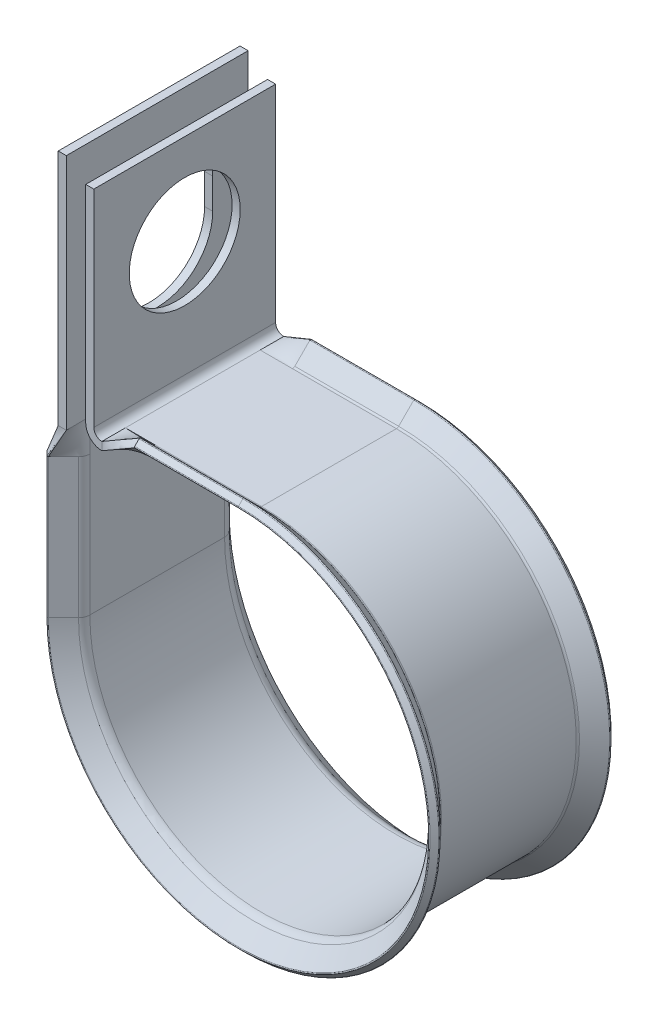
SolidWorks part; units mm, degrees
ref_plane "Front Plane" through (0, 0, 0) normal (0, 0, 1) x (1, 0, 0)
ref_plane "Top Plane" through (0, 0, 0) normal (0, 1, 0) x (1, 0, 0)
ref_plane "Right Plane" through (0, 0, 0) normal (1, 0, 0) x (0, 0, -1)
sketch "Sketch1" plane through (0, 0, 0) normal (0, 0, 1) x (1, 0, 0)
  line L0 (0, -23.8252) -> (0, 8.3312)
  line L1 (13.4874, -10.3378) -> (2.794, -10.3378)
  line L2 (1.524, -9.0678) -> (1.524, 7.1374)
  arc A0 (0, -23.8252) -> (13.4874, -10.3378) centre (13.4874, -23.8252) ccw
  arc A1 (2.794, -10.3378) -> (1.524, -9.0678) centre (2.794, -9.0678) cw
  dimension "D3" = 1.27
  dimension "D Clamp Diameter" = 26.9748
  dimension "L Center to Center" = 23.8252
  dimension "F Slot Center to End" = 8.3312
  dimension "E Hole Center to End" = 7.1374
  dimension "D6" = 1.524
extrude "Extrude-Thin1" add sketch "Sketch1" along normal mid plane 14.2748 thin
sketch "Sketch2" plane through (2.159, 0, 0) normal (1, 0, 0) x (0, 0, -1)
  circle A0 centre (0, 0) radius 4.3561
  dimension "H Hole Diameter" = 8.7122
extrude "Cut-Extrude1" cut sketch "Sketch2" against normal up to next
sketch "Sketch3" plane through (-0.635, 0, 0) normal (-1, 0, 0) x (0, 0, 1)
  line L0 (0, -1.1938) -> (0, 1.1938) construction
  line L1 (-4.3561, -1.1938) -> (-4.3561, 1.1938)
  line L2 (4.3561, -1.1938) -> (4.3561, 1.1938)
  arc A0 (-4.3561, -1.1938) -> (4.3561, -1.1938) centre (0, -1.1938) ccw
  arc A1 (4.3561, 1.1938) -> (-4.3561, 1.1938) centre (0, 1.1938) ccw
  point P2 (0, 0)
  dimension "H Slot Width" = 8.7122
  dimension "S Slot Length" = 11.0998
extrude "Cut-Extrude2" cut sketch "Sketch3" against normal up to next
sketch "Sketch4" plane through (0, 0, 0) normal (0, 0, 1) x (1, 0, 0)
  line L0 (2.794, -10.3378) -> (13.4874, -10.3378)
  line L1 (0, -23.8252) -> (0, -10.3378)
  line L2 (0, 8.3312) -> (0, -23.8252) construction
  arc A0 (13.4874, -10.3378) -> (0, -23.8252) centre (13.4874, -23.8252) cw
ref_plane "Plane1" through (2.794, 0, 0) normal (1, 0, 0) x (0, 0, -1)
sketch "Sketch5" plane through (2.794, 0, 0) normal (1, 0, 0) x (0, 0, -1)
  line L3 (-7.1374, -9.7028) -> (-5.1054, -9.7028)
  line L4 (-7.1374, -9.7028) -> (-7.1374, -10.3378)
  line L5 (-7.1374, -10.3378) -> (-5.1054, -10.3378)
  line L6 (-5.1054, -9.7028) -> (-5.1054, -10.3378)
  line L7 (7.1374, -9.7028) -> (5.1054, -9.7028)
  line L8 (7.1374, -9.7028) -> (7.1374, -10.3378)
  line L9 (7.1374, -10.3378) -> (5.1054, -10.3378)
  line L10 (5.1054, -9.7028) -> (5.1054, -10.3378)
  dimension "D1" = 0.635
  dimension "D2" = 2.032
  dimension "D3" = 2.032
  dimension "D4" = 0.635
sweep "Cut-Sweep1" cut profiles "Sketch5" path "Sketch4"
sketch "Sketch6" plane through (2.794, 0, 0) normal (1, 0, 0) x (0, 0, -1)
  line L0 (-5.1054, -10.3378) -> (-5.1054, -9.7028)
  line L1 (7.1027, -8.7843) -> (6.7615, -8.443)
  line L2 (-5.1054, -9.7028) -> (-5.2887, -9.7028)
  line L3 (7.1027, -8.892) -> (5.9173, -10.0774)
  line L4 (5.4683, -9.6284) -> (6.6537, -8.443)
  line L5 (-5.4683, -9.6284) -> (-6.6537, -8.443)
  line L6 (5.1054, -10.3378) -> (5.2887, -10.3378)
  line L7 (-7.1027, -8.892) -> (-5.9173, -10.0774)
  line L8 (5.1054, -9.7028) -> (5.2887, -9.7028)
  line L9 (-5.1054, -9.7028) -> (5.1054, -9.7028) construction
  line L10 (5.1054, -10.3378) -> (5.1054, -9.7028)
  line L11 (-5.3939, -9.7028) -> (-6.528, -8.5687) construction
  line L14 (-6.977, -9.0177) -> (-5.5878, -10.4069) construction
  line L15 (-7.1027, -8.7843) -> (-6.7615, -8.443)
  line L16 (-7.3362, -9.0177) -> (-6.528, -8.2095) construction
  line L17 (0, -9.7028) -> (0, -9.0678) construction
  line L18 (-7.1374, -9.0678) -> (7.1374, -9.0678) construction
  line L19 (-7.3362, -9.0177) -> (-5.7674, -10.5865) construction
  line L20 (-5.2887, -9.4488) -> (-6.528, -8.2095) construction
  line L21 (-6.977, -9.0177) -> (-6.528, -8.5687) construction
  line L22 (-5.1054, -9.7028) -> (-5.3939, -9.7028) construction
  line L23 (-5.1054, -10.3378) -> (-5.2887, -10.3378)
  line L27 (-4.8514, -9.4488) -> (-5.2887, -9.4488) construction
  line L28 (-4.8514, -10.3378) -> (-4.8514, -9.4488) construction
  arc A0 (-7.1027, -8.892) -> (-7.1027, -8.7843) centre (-7.0488, -8.8381) cw
  arc A1 (-6.7615, -8.443) -> (-6.6537, -8.443) centre (-6.7076, -8.4969) cw
  arc A2 (-5.4683, -9.6284) -> (-5.2887, -9.7028) centre (-5.2887, -9.4488) ccw
  arc A3 (-5.9173, -10.0774) -> (-5.2887, -10.3378) centre (-5.2887, -9.4488) ccw
  arc A4 (6.7615, -8.443) -> (6.6537, -8.443) centre (6.7076, -8.4969) ccw
  arc A5 (7.1027, -8.892) -> (7.1027, -8.7843) centre (7.0488, -8.8381) ccw
  arc A6 (5.4683, -9.6284) -> (5.2887, -9.7028) centre (5.2887, -9.4488) cw
  arc A7 (5.9173, -10.0774) -> (5.2887, -10.3378) centre (5.2887, -9.4488) cw
  dimension "D4" = 0.254
  dimension "D5" = 0.889
  dimension "D6" = 0.0762
  dimension "D8" = 0.4826
  dimension "D2" = 135
  dimension "D7" = 1.6764
  dimension "D3" = 0.1833
  dimension "D9" = 1.6764
sketch "Sketch7" plane through (0, 0, 0) normal (0, 0, 1) x (1, 0, 0)
  line L0 (2.794, -10.3378) -> (13.4874, -10.3378)
  line L1 (2.794, -10.3378) -> (2.794, -9.7028) construction
  line L2 (2.794, -10.3378) -> (2.794, -10.0774) construction
  line L3 (0, -23.8252) -> (0, -10.3378)
  arc A0 (13.4874, -10.3378) -> (0, -23.8252) centre (13.4874, -23.8252) cw
sweep "Sweep1" add profiles "Sketch6" path "Sketch7"
sketch "Sketch8" plane through (-0.635, 0, 0) normal (-1, 0, 0) x (0, 0, 1)
  line L0 (-5.2887, -23.8252) -> (-5.2887, -10.3378) construction
  line L1 (-7.1374, -10.3378) -> (-5.2887, -10.3378)
  line L2 (-7.1374, -10.3378) -> (-7.1374, -12.8778)
  line L3 (-7.1374, -12.8778) -> (-5.2887, -12.8778)
  line L4 (-5.2887, -10.3378) -> (-5.2887, -12.8778)
  line L5 (5.2887, -23.8252) -> (5.2887, -10.3378) construction
  line L6 (7.1374, -10.3378) -> (5.2887, -10.3378)
  line L7 (7.1374, -10.3378) -> (7.1374, -12.8778)
  line L8 (7.1374, -12.8778) -> (5.2887, -12.8778)
  line L9 (5.2887, -10.3378) -> (5.2887, -12.8778)
  dimension "D1" = 2.54
  dimension "D2" = 2.54
extrude "Cut-Extrude3" cut sketch "Sketch8" against normal mid plane 5.08
loft "Loft1" add
loft "Loft2" add
ref_plane "Plane2" through (2.794, 0, 0) normal (1, 0, 0) x (0, 0, -1)
sketch "Sketch9" plane through (2.794, 0, 0) normal (1, 0, 0) x (0, 0, -1)
  line L0 (0, -0.4254) -> (0, -6.985) construction
  line L1 (-5.2887, -10.3378) -> (-7.8287, -10.3378)
  line L2 (-5.2887, -10.3378) -> (-5.2887, -7.7978)
  line L3 (-5.2887, -7.7978) -> (-7.8287, -7.7978)
  line L4 (-7.8287, -10.3378) -> (-7.8287, -7.7978)
  line L5 (7.8287, -10.3378) -> (7.8287, -7.7978)
  line L6 (5.2887, -10.3378) -> (7.8287, -10.3378)
  line L7 (5.2887, -10.3378) -> (5.2887, -7.7978)
  line L8 (5.2887, -7.7978) -> (7.8287, -7.7978)
  dimension "D1" = 2.54
  dimension "D2" = 2.54
extrude "Cut-Extrude4" cut sketch "Sketch9" along normal blind 2.54
sketch3d "3DSketch1"
  line L0 (2.794, -9.7028, 7.1374) -> (5.334, -8.443, 6.6537)
loft "Loft3" add
sketch3d "3DSketch2"
  line L0 (2.794, -9.7028, -7.1374) -> (5.334, -8.443, -6.7615)
  arc A0 (5.334, -8.443, -6.7615) -> (5.334, -8.443, -6.6537) centre (5.334, -8.4969, -6.7076) ccw construction
  point P8 (5.4102, -8.4969, -6.7076)
loft "Loft4" add
